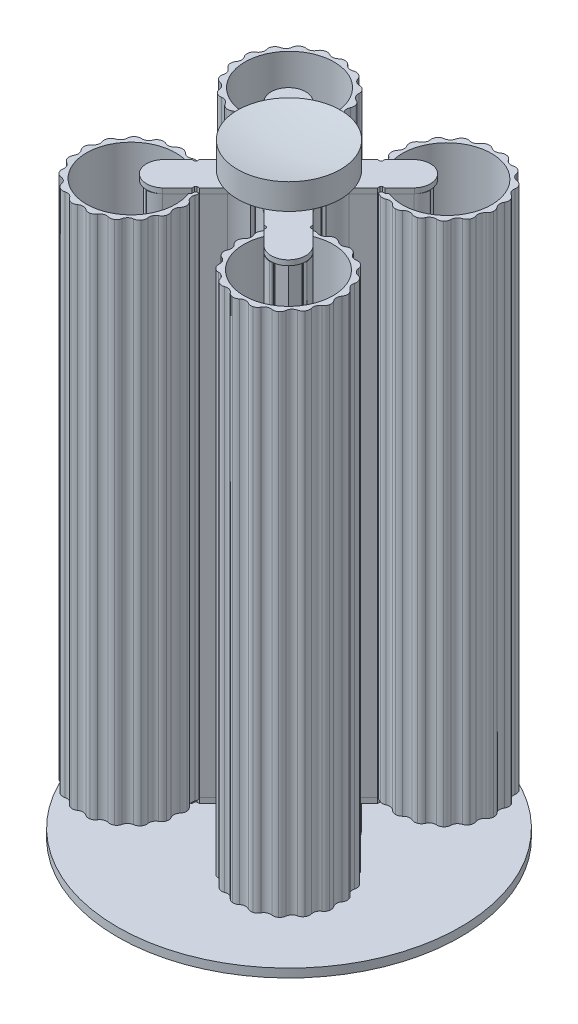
SolidWorks part; units mm, degrees
ref_plane "Alzado" through (0, 0, 0) normal (0, 0, 1) x (1, 0, 0)
ref_plane "Planta" through (0, 0, 0) normal (0, 1, 0) x (1, 0, 0)
ref_plane "Vista lateral" through (0, 0, 0) normal (1, 0, 0) x (0, 0, -1)
imported_body "Drawing1 (1).iges-1/Drawing1 (1)4.iges-1-surface1"
imported_body "Drawing1 (1).iges-1/Drawing1 (1)18.iges-1-solid1"
imported_body "Drawing1 (1).iges-1/Drawing1 (1)19.iges-1-solid1"
imported_body "Drawing1 (1).iges-1/Drawing1 (1)20.iges-1-solid1"
imported_body "Drawing1 (1).iges-1/Drawing1 (1)21.iges-1-solid1"
imported_body "Drawing1 (1).iges-1/Drawing1 (1)22.iges-1-solid1"
imported_body "Drawing1 (1).iges-1/Drawing1 (1)23.iges-1-solid1"
imported_body "Drawing1 (1).iges-1/Drawing1 (1)25.iges-1-solid1"
ref_plane "Plano1" through (0, 180, 0) normal (0, 1, 0) x (1, 0, 0)
sketch "Croquis1" plane through (0, 180, 0) normal (0, 1, 0) x (1, 0, 0)
  line L0 (3849.5575, 5974.6939) -> (3762.5833, 5887.7198) construction
  line L10 (3852.2781, 6007.4146) -> (3852.2781, 5947.4146) construction
  circle A0 centre (3852.2781, 5977.4146) radius 26
  arc A5 (3849.911, 5960.7639) -> (3835.6274, 5975.0475) centre (3842.4065, 5967.5429) ccw construction
  arc A8 (3762.2298, 5901.6498) -> (3776.5133, 5887.3662) centre (3769.7343, 5894.8708) ccw construction
  circle A15 centre (3852.2781, 5977.4146) radius 30
  circle A16 centre (3806.0709, 5931.5148) radius 30 construction
  circle A17 centre (3851.9707, 5885.3076) radius 26
  circle A18 centre (3851.9707, 5885.3076) radius 30
  circle A19 centre (3759.8637, 5885.615) radius 26
  circle A20 centre (3759.8637, 5885.615) radius 30
  circle A21 centre (3760.1711, 5977.722) radius 26
  circle A22 centre (3760.1711, 5977.722) radius 30
  point P28 (3806.0709, 5931.5148)
  dimension "D1" = 52
  dimension "D2" = 60
  dimension "D3" = 4
extrude "Saliente-Extruir1" add sketch "Croquis1" along normal blind 306 separate body
sketch "Croquis2" plane through (0, 486, 0) normal (0, 1, 0) x (1, 0, 0)
  circle A1 centre (3852.2781, 5977.4146) radius 32 construction
  circle A72 centre (3852.2781, 6009.4146) radius 4
  circle A73 centre (3863.8378, 6007.2537) radius 4
  circle A74 centre (3873.8364, 6001.0629) radius 4
  circle A75 centre (3880.9233, 5991.6782) radius 4
  circle A76 centre (3884.1416, 5980.3672) radius 4
  circle A77 centre (3883.0565, 5968.6574) radius 4
  circle A78 centre (3877.8147, 5958.1303) radius 4
  circle A79 centre (3869.1239, 5950.2076) radius 4
  circle A80 centre (3858.1581, 5945.9595) radius 4
  circle A81 centre (3846.3981, 5945.9595) radius 4
  circle A84 centre (3821.4997, 5968.6574) radius 4
  circle A85 centre (3820.4146, 5980.3672) radius 4
  circle A86 centre (3823.6329, 5991.6782) radius 4
  circle A87 centre (3830.7199, 6001.0629) radius 4
  circle A88 centre (3840.7184, 6007.2537) radius 4
  circle A89 centre (3806.0709, 5931.5148) radius 30 construction
  circle A90 centre (3826.7416, 5958.1303) radius 4
  circle A91 centre (3835.4323, 5950.2076) radius 4
  circle A92 centre (3843.2135, 5916.086) radius 4
  circle A93 centre (3854.9233, 5917.1711) radius 4
  circle A94 centre (3866.2343, 5913.9528) radius 4
  circle A95 centre (3875.619, 5906.8659) radius 4
  circle A96 centre (3881.8098, 5896.8673) radius 4
  circle A97 centre (3883.9707, 5885.3076) radius 4
  circle A98 centre (3881.8098, 5873.7479) radius 4
  circle A99 centre (3875.619, 5863.7493) radius 4
  circle A100 centre (3866.2343, 5856.6624) radius 4
  circle A101 centre (3854.9233, 5853.4441) radius 4
  circle A102 centre (3843.2135, 5854.5292) radius 4
  circle A103 centre (3832.6864, 5859.771) radius 4
  circle A104 centre (3824.7637, 5868.4618) radius 4
  circle A105 centre (3820.5155, 5879.4276) radius 4
  circle A106 centre (3820.5155, 5891.1876) radius 4
  circle A107 centre (3790.6421, 5894.3723) radius 4
  circle A108 centre (3791.7272, 5882.6625) radius 4
  circle A109 centre (3788.5089, 5871.3514) radius 4
  circle A110 centre (3781.4219, 5861.9668) radius 4
  circle A111 centre (3771.4234, 5855.7759) radius 4
  circle A112 centre (3759.8637, 5853.615) radius 4
  circle A113 centre (3748.3039, 5855.7759) radius 4
  circle A114 centre (3738.3054, 5861.9668) radius 4
  circle A115 centre (3731.2185, 5871.3514) radius 4
  circle A116 centre (3728.0002, 5882.6625) radius 4
  circle A117 centre (3729.0853, 5894.3723) radius 4
  circle A118 centre (3734.3271, 5904.8993) radius 4
  circle A119 centre (3743.0179, 5912.822) radius 4
  circle A120 centre (3753.9837, 5917.0702) radius 4
  circle A121 centre (3765.7437, 5917.0702) radius 4
  circle A122 centre (3768.9283, 5946.9436) radius 4
  circle A123 centre (3757.2185, 5945.8585) radius 4
  circle A124 centre (3745.9075, 5949.0768) radius 4
  circle A125 centre (3736.5228, 5956.1638) radius 4
  circle A126 centre (3730.332, 5966.1623) radius 4
  circle A127 centre (3728.1711, 5977.722) radius 4
  circle A128 centre (3730.332, 5989.2818) radius 4
  circle A129 centre (3736.5228, 5999.2803) radius 4
  circle A130 centre (3745.9075, 6006.3673) radius 4
  circle A131 centre (3757.2185, 6009.5855) radius 4
  circle A132 centre (3768.9283, 6008.5005) radius 4
  circle A133 centre (3779.4554, 6003.2586) radius 4
  circle A134 centre (3787.3781, 5994.5679) radius 4
  circle A135 centre (3791.6263, 5983.602) radius 4
  circle A136 centre (3791.6263, 5971.842) radius 4
  point P40 (3852.2781, 5977.4146)
  point P150 (3806.0709, 5931.5148)
  dimension "D1" = 64
  dimension "D2" = 17
  dimension "D3" = 4
extrude "Cortar-Extruir1" cut sketch "Croquis2" against normal blind 306
ref_plane "Plano2" through (0, 195, 0) normal (0, 1, 0) x (1, 0, 0)
ref_plane "Plano3" through (0, 470, 0) normal (0, 1, 0) x (1, 0, 0)
fillet "Redondeo1" radius 4 30 edges at (3733.5815, 333, -5963.8298) (3731.162, 333, -5970.0752) (3730.3586, 333, -5974.3732) (3730.3586, 333, -5981.0709) (3771.5507, 333, -5949.9641) (3765.1087, 333, -5948.1311) (3790.0914, 333, -5975.5358) (3788.8607, 333, -5968.9522) (3788.8607, 333, -5986.4919) (3790.0914, 333, -5979.9082) (3783.7553, 333, -5996.2635) (3787.2812, 333, -5990.569) (3775.4647, 333, -6003.5311) (3780.8096, 333, -5999.4948) (3765.1087, 333, -6007.3129) (3771.5507, 333, -6005.48) (3754.0858, 333, -6007.0984) (3760.7549, 333, -6007.7164) (3743.8848, 333, -6002.9164) (3749.8803, 333, -6005.9018) (3735.8833, 333, -5995.3318) (3740.3955, 333, -6000.2814) (3731.162, 333, -5985.3688) (3733.5815, 333, -5991.6143) (3760.7549, 333, -5947.7277) (3754.0858, 333, -5948.3457) (3749.8803, 333, -5949.5423) (3743.8848, 333, -5952.5277) (3740.3955, 333, -5955.1626) (3735.8833, 333, -5960.1123)
fillet "Redondeo2" radius 4 30 edges at (3850.0919, 333, -5947.4944) (3843.5082, 333, -5948.7251) (3861.048, 333, -5948.7251) (3854.4643, 333, -5947.4944) (3870.8196, 333, -5953.8304) (3865.1251, 333, -5950.3046) (3878.0871, 333, -5962.121) (3874.0509, 333, -5956.7761) (3881.869, 333, -5972.477) (3880.0361, 333, -5966.035) (3881.6544, 333, -5983.4999) (3882.2724, 333, -5976.8308) (3877.4725, 333, -5993.7009) (3880.4579, 333, -5987.7054) (3869.8878, 333, -6001.7024) (3874.8375, 333, -5997.1902) (3859.9249, 333, -6006.4237) (3866.1703, 333, -6004.0042) (3848.9293, 333, -6007.2271) (3855.627, 333, -6007.2271) (3838.3859, 333, -6004.0042) (3844.6313, 333, -6006.4237) (3829.7187, 333, -5997.1902) (3834.6684, 333, -6001.7024) (3824.0983, 333, -5987.7054) (3827.0838, 333, -5993.7009) (3822.2838, 333, -5976.8308) (3822.9018, 333, -5983.4999) (3824.5201, 333, -5966.035) (3822.6872, 333, -5972.477)
fillet "Redondeo3" radius 4 30 edges at (3822.0504, 333, -5887.4938) (3823.2811, 333, -5894.0775) (3823.2811, 333, -5876.5377) (3822.0504, 333, -5883.1214) (3828.3865, 333, -5866.7661) (3824.8606, 333, -5872.4606) (3836.6771, 333, -5859.4986) (3831.3322, 333, -5863.5348) (3847.0331, 333, -5855.7167) (3840.5911, 333, -5857.5496) (3858.056, 333, -5855.9313) (3851.3869, 333, -5855.3133) (3868.257, 333, -5860.1133) (3862.2615, 333, -5857.1278) (3876.2585, 333, -5867.6979) (3871.7463, 333, -5862.7482) (3880.9798, 333, -5877.6608) (3878.5603, 333, -5871.4154) (3881.7832, 333, -5888.6565) (3881.7832, 333, -5881.9587) (3878.5603, 333, -5899.1998) (3880.9798, 333, -5892.9544) (3871.7463, 333, -5907.867) (3876.2585, 333, -5902.9173) (3862.2615, 333, -5913.4874) (3868.257, 333, -5910.5019) (3851.3869, 333, -5915.3019) (3858.056, 333, -5914.6839) (3840.5911, 333, -5913.0656) (3847.0331, 333, -5914.8985)
fillet "Redondeo4" radius 4 30 edges at (3787.6217, 333, -5896.9946) (3789.4546, 333, -5890.5526) (3789.858, 333, -5886.1989) (3789.24, 333, -5879.5297) (3788.0435, 333, -5875.3242) (3785.058, 333, -5869.3287) (3782.4231, 333, -5865.8394) (3777.4734, 333, -5861.3272) (3773.7559, 333, -5859.0255) (3767.5105, 333, -5856.606) (3763.2125, 333, -5855.8025) (3756.5148, 333, -5855.8025) (3752.2169, 333, -5856.606) (3745.9714, 333, -5859.0255) (3742.254, 333, -5861.3272) (3737.3043, 333, -5865.8394) (3734.6693, 333, -5869.3287) (3731.6839, 333, -5875.3242) (3730.4874, 333, -5879.5297) (3729.8694, 333, -5886.1989) (3730.2728, 333, -5890.5526) (3732.1057, 333, -5896.9946) (3734.0547, 333, -5900.9086) (3738.0909, 333, -5906.2535) (3741.3222, 333, -5909.1992) (3747.0167, 333, -5912.7251) (3751.0938, 333, -5914.3046) (3757.6775, 333, -5915.5353) (3762.0499, 333, -5915.5353) (3768.6336, 333, -5914.3046)
ref_plane "Plano4" through (0, 158, 0) normal (0, 1, 0) x (1, 0, 0)
sketch "Croquis3" plane through (0, 158, 0) normal (0, 1, 0) x (1, 0, 0)
  circle A0 centre (3806.0709, 5931.5148) radius 100
  dimension "D1" = 200
extrude "Saliente-Extruir2" add sketch "Croquis3" against normal blind 5
